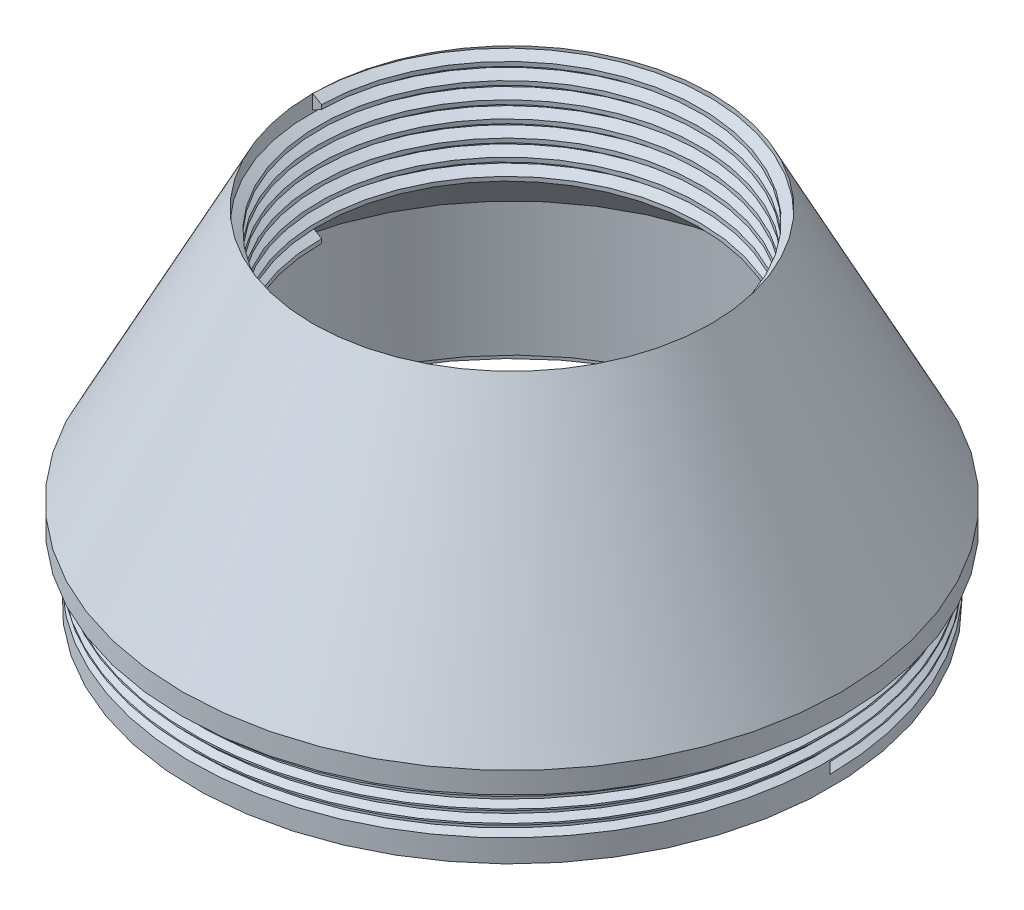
SolidWorks part; units mm, degrees
ref_plane "Frontal Plane" through (0, 0, 0) normal (0, 0, 1) x (1, 0, 0)
ref_plane "Horizontal Plane" through (0, 0, 0) normal (0, 1, 0) x (1, 0, 0)
ref_plane "Profile Plane" through (0, 0, 0) normal (1, 0, 0) x (0, 0, -1)
sketch "Sketch1" plane through (0, 0, 0) normal (0, 0, 1) x (1, 0, 0)
  line L5 (0, 0) -> (0, 5.7912)
  line L6 (0, 5.7912) -> (-1.016, 5.7912)
  line L8 (10.1092, 29.1592) -> (10.1092, 19.8882)
  line L9 (0, 0) -> (1.4732, 0)
  line L10 (1.4732, 0) -> (1.4732, 1.7272)
  line L11 (1.4732, 1.7272) -> (3.556, 1.7272)
  line L12 (3.556, 1.7272) -> (3.556, 13.0848)
  line L13 (3.556, 13.0848) -> (10.1092, 19.8882)
  line L14 (27.0764, 36.0656) -> (27.0764, -9.8806) construction
  line L15 (-1.016, 5.7912) -> (-1.016, 7.607)
  line L16 (-1.016, 7.607) -> (10.1092, 29.1592)
  point P2 (-1.016, 6.6991)
  dimension "D1" = 29.1592
  dimension "D2" = 5.7912
  dimension "D3" = 1.7272
  dimension "D4" = 3.556
  dimension "D5" = 2.0828
  dimension "D6" = 11.1252
  dimension "D7" = 9.271
  dimension "D8" = 16.9672
  dimension "D9" = 23.5204
  dimension "D10" = 7.607
  dimension "D11" = 13.0848
revolve "Revolve1" add sketch "Sketch1" angle 360 about L14
thread "Thread1" pitch 1.0583 start angle 0, offset 1, length 0, pitch 1.0583, diameter 54.1528
ref_plane "Plane1" through (54.1528, 1, 0) normal (0, 0, 1) x (1, 0, 0)
sketch "Thread Profile1" plane through (54.1528, 1, 0) normal (0, 0, 1) x (1, 0, 0)
  line L0 (0, 0) -> (0, 1.0583) construction
  line L11 (0, 0) -> (0, 0.926)
  line L12 (0, 0.926) -> (-0.5728, 0.5953)
  line L13 (-0.5728, 0.5953) -> (-0.5728, 0.3307)
  line L15 (-0.5728, 0.3307) -> (0, 0)
  line L17 (-0.5728, 0.463) -> (0, 0.463) construction
  point P2 (0, 0)
  dimension "Pitch" = 1.0583
  dimension "Profile_Angle" = 60
  dimension "Profile_Land" = 0.2646
  dimension "Profile_Height" = 0.5728
thread "Thread2" pitch 1.4111 start angle 0, offset 0, length 0, pitch 1.4111, diameter 33.9344
ref_plane "Plane2" through (10.1092, 29.1592, 0) normal (0, 0, 1) x (-1, 0, 0)
sketch "Thread Profile2" plane through (10.1092, 29.1592, 0) normal (0, 0, 1) x (-1, 0, 0)
  line L0 (0, 0) -> (0, 1.4111) construction
  line L11 (0, 0) -> (0, 1.2347)
  line L12 (0, 1.2347) -> (-0.7638, 0.7937)
  line L13 (-0.7638, 0.7937) -> (-0.7638, 0.441)
  line L15 (-0.7638, 0.441) -> (0, 0)
  line L17 (-0.7638, 0.6174) -> (0, 0.6174) construction
  point P2 (0, 0)
  dimension "Pitch" = 1.4111
  dimension "Profile_Angle" = 60
  dimension "Profile_Land" = 0.3528
  dimension "Profile_Height" = 0.7638
